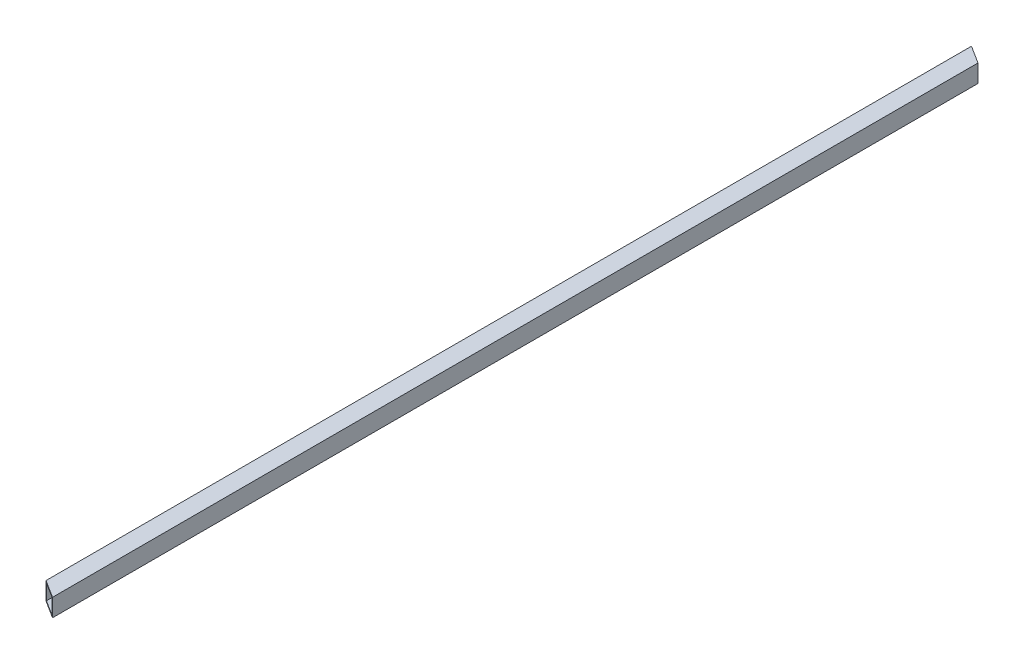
SolidWorks part; units mm, degrees
ref_plane "Front" through (0, 0, 0) normal (0, 0, 1) x (1, 0, 0)
ref_plane "Top" through (0, 0, 0) normal (0, 1, 0) x (1, 0, 0)
ref_plane "Right" through (0, 0, 0) normal (1, 0, 0) x (0, 0, -1)
sketch "Sketch1" plane through (0, 0, 0) normal (0, 0, 1) x (1, 0, 0)
  line L0 (3.175, 3.175) -> (47.625, 3.175)
  line L1 (0, 0) -> (50.8, 0)
  line L2 (0, 0) -> (0, 50.8)
  line L3 (0, 50.8) -> (50.8, 50.8)
  line L4 (50.8, 0) -> (50.8, 50.8)
  line L5 (47.625, 3.175) -> (47.625, 47.625)
  line L6 (3.175, 47.625) -> (47.625, 47.625)
  line L7 (3.175, 3.175) -> (3.175, 47.625)
  dimension "D1" = 50.8
  dimension "D2" = 50.8
  dimension "D3" = 3.175
extrude "Extrude1" add sketch "Sketch1" along normal blind 2677.0203
sketch "Sketch2" plane through (0, 0, 0) normal (0, -1, 0) x (1, 0, 0)
  line L0 (-62.4955, 2677.0203) -> (-62.4955, 2605.4129)
  line L2 (50.8, 2677.0203) -> (-62.4955, 2677.0203)
  line L4 (160.0031, 101.1286) -> (160.0031, 0)
  line L5 (160.0031, 0) -> (0, 0)
  line L8 (50.8, 2677.0203) -> (-62.4955, 2605.4129)
  line L9 (0, 0) -> (160.0031, 101.1286)
extrude "Extrude2" cut sketch "Sketch2" against normal through all
